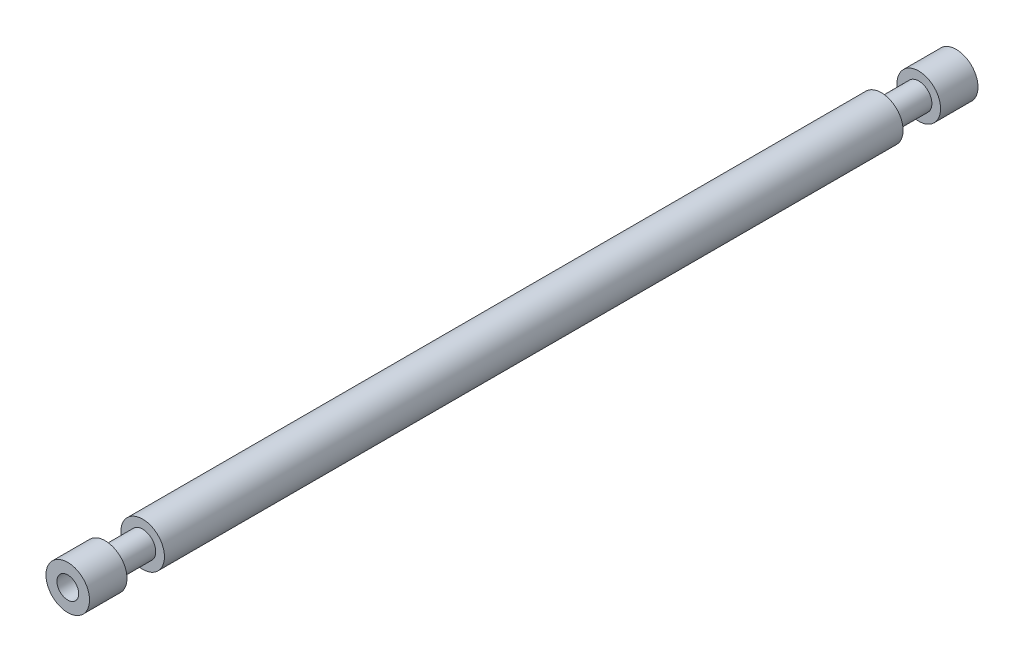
SolidWorks part; units mm, degrees
ref_plane "Plane1" through (0, 0, 0) normal (0, 0, 1) x (1, 0, 0)
ref_plane "Plane2" through (0, 0, 0) normal (0, 1, 0) x (1, 0, 0)
ref_plane "Plane3" through (0, 0, 0) normal (1, 0, 0) x (0, 0, -1)
sketch "Sketch1" plane through (0, 0, 0) normal (0, 0, 1) x (1, 0, 0)
  circle A0 centre (0, 0) radius 6.35
  dimension "D1" = 12.7
extrude "Base-Extrude" add sketch "Sketch1" along normal blind 259.08
ref_plane "Plane4" through (0, 0, 248.158) normal (0, 0, 1) x (1, 0, 0)
sketch "Sketch2" plane through (0, 0, 248.158) normal (0, 0, 1) x (1, 0, 0)
  circle A0 centre (0, 0) radius 7.0352
  circle A1 centre (0, 0) radius 3.81
  dimension "D1" = 7.62
extrude "Cut-Extrude1" cut sketch "Sketch2" against normal blind 10.922
ref_plane "Plane5" through (0, 0, 10.922) normal (0, 0, -1) x (-1, 0, 0)
sketch "Sketch3" plane through (0, 0, 10.922) normal (0, 0, -1) x (-1, 0, 0)
  circle A0 centre (0, 0) radius 6.7797
  circle A1 centre (0, 0) radius 3.8299
  dimension "D1" = 7.6598
extrude "Cut-Extrude2" cut sketch "Sketch3" against normal blind 10.922
hole_wizard "1/4-20 Tapped Hole 1" positions "Sketch5" profile "Sketch4" legacy
sketch "Sketch5" plane through (-1.1421, 1.9355, 0) normal (0, 0, -1) x (-1, 0, 0)
  point P0 (-1.1452, -1.9468)
sketch "Sketch4" plane through (0.0031, -0.0113, 0) normal (1, 0, 0) x (0, 1, 0)
  line L0 (0, 0) -> (0, 25.4)
  line L1 (0, 25.4) -> (2.5527, 23.8662)
  line L2 (2.5527, 23.8662) -> (2.5527, 0.0025)
  line L3 (2.5527, 0.0025) -> (2.5527, 0)
  line L4 (2.5527, 0) -> (0, 0)
hole_wizard "1/4-20 Tapped Hole 4" positions "Sketch11" profile "Sketch10" legacy
sketch "Sketch11" plane through (0.1851, 0.0793, 259.08) normal (0, 0, 1) x (1, 0, 0)
  point P0 (-0.1706, -0.0747)
sketch "Sketch10" plane through (0.0145, 0.0046, 259.08) normal (1, 0, 0) x (0, -1, 0)
  line L0 (0, 0) -> (0, 12.7)
  line L1 (0, 12.7) -> (2.5527, 11.1662)
  line L2 (2.5527, 11.1662) -> (2.5527, 11.43)
  line L3 (2.5527, 11.43) -> (3.175, 11.43)
  line L4 (3.175, 11.43) -> (3.175, 0.0025)
  line L5 (3.175, 0.0025) -> (3.175, 0)
  line L6 (3.175, 0) -> (0, 0)
